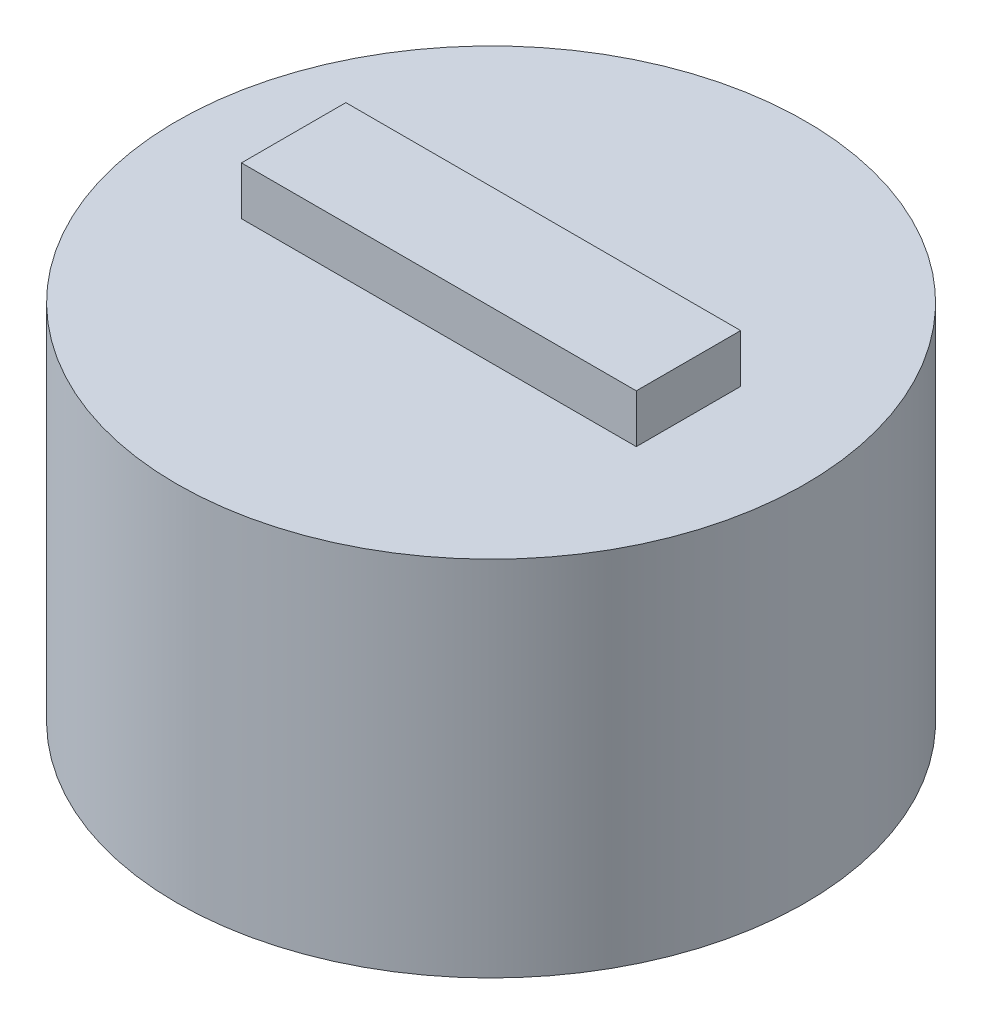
SolidWorks part; units mm, degrees
ref_plane "Front Plane" through (0, 0, 0) normal (0, 0, 1) x (1, 0, 0)
ref_plane "Top Plane" through (0, 0, 0) normal (0, 1, 0) x (1, 0, 0)
ref_plane "Right Plane" through (0, 0, 0) normal (1, 0, 0) x (0, 0, -1)
sketch "Sketch1" plane through (0, 0, 0) normal (0, 1, 0) x (1, 0, 0)
  circle A0 centre (0, 0) radius 65
  dimension "D1" = 130
extrude "Boss-Extrude1" add sketch "Sketch1" along normal blind 70
shell "Shell1" thickness 5
sketch "Sketch2" plane through (0, 5, 0) normal (0, 1, 0) x (1, 0, 0)
  circle A0 centre (0, 0) radius 25
  dimension "D1" = 50
extrude "Boss-Extrude2" add sketch "Sketch2" along normal blind 35
sketch "Sketch3" plane through (0, 70, 0) normal (0, 1, 0) x (1, 0, 0)
  circle A0 centre (0, 0) radius 65 construction
  circle A1 centre (0, 0) radius 65
extrude "Boss-Extrude3" add sketch "Sketch3" along normal blind 5
sketch "Sketch4" plane through (0, 75, 0) normal (0, 1, 0) x (1, 0, 0)
  line L1 (40.8204, -10.7904) -> (-40.8204, -10.7904)
  line L2 (40.8204, -10.7904) -> (40.8204, 10.7904)
  line L3 (40.8204, 10.7904) -> (-40.8204, 10.7904)
  line L4 (-40.8204, -10.7904) -> (-40.8204, 10.7904)
  line L5 (40.8204, -10.7904) -> (-40.8204, 10.7904) construction
  line L6 (40.8204, 10.7904) -> (-40.8204, -10.7904) construction
  point P0 (0, 0)
extrude "Boss-Extrude4" add sketch "Sketch4" along normal blind 10
